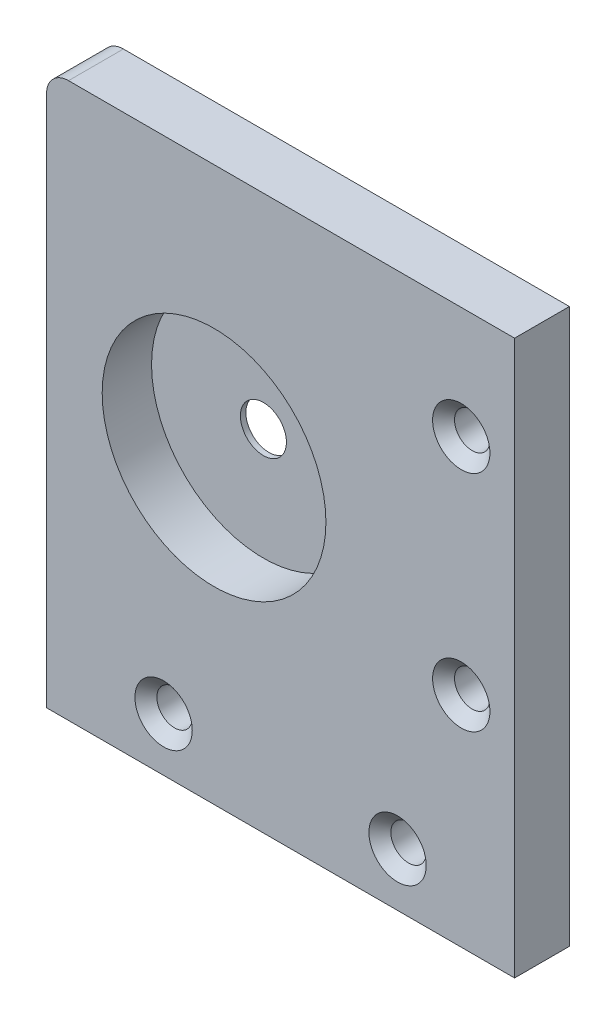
SolidWorks part; units mm, degrees
ref_plane "Front Plane" through (0, 0, 0) normal (0, 0, 1) x (1, 0, 0)
ref_plane "Top Plane" through (0, 0, 0) normal (0, 1, 0) x (1, 0, 0)
ref_plane "Right Plane" through (0, 0, 0) normal (1, 0, 0) x (0, 0, -1)
sketch "Sketch1" plane through (0, 0, 0) normal (0, 0, 1) x (1, 0, 0)
  line L6 (-810.8141, 612.9135) -> (-817.6657, 612.9135)
  line L7 (-810.8141, 612.9135) -> (-779.225, 612.9135)
  line L8 (-493.7649, 564.4955) -> (-493.7649, 1167.7963)
  line L9 (-493.7649, 1167.7963) -> (-817.6657, 1167.7963)
  line L10 (-817.6657, 1167.7963) -> (-817.6657, 564.4955)
  line L11 (-817.6657, 564.4955) -> (-493.7649, 564.4955)
  line L12 (-779.225, 612.9135) -> (-779.225, 571.3471)
  line L13 (-779.225, 571.3471) -> (-779.225, 564.4955)
  circle A2 centre (-798.6157, 583.5455) radius 2.667
extrude "Boss-Extrude1" add sketch "Sketch1" along normal blind 6.35 contours L13 L12 L7 L6 L10 L11 A2
sketch "Sketch2" plane through (0, 0, 6.35) normal (0, 0, 1) x (1, 0, 0)
  line L0 (-779.225, 564.4955) -> (-779.225, 555.0975)
  line L1 (-817.6657, 612.9135) -> (-827.0637, 612.9135)
  line L3 (-827.0637, 612.9135) -> (-779.225, 612.9135)
  line L4 (-779.225, 564.4955) -> (-779.225, 612.9135)
  line L5 (-779.225, 612.9135) -> (-817.6657, 612.9135)
  line L6 (-817.6657, 612.9135) -> (-817.6657, 564.4955)
  line L7 (-817.6657, 564.4955) -> (-779.225, 564.4955)
  line L8 (-779.225, 564.4955) -> (-779.225, 612.9135)
  line L9 (-779.225, 612.9135) -> (-817.6657, 612.9135)
  line L10 (-817.6657, 612.9135) -> (-817.6657, 564.4955)
  line L11 (-817.6657, 564.4955) -> (-779.225, 564.4955)
  line L12 (-827.0637, 612.9135) -> (-827.0637, 555.0975)
  line L13 (-827.0637, 555.0975) -> (-779.225, 555.0975)
  line L14 (-779.225, 612.9135) -> (-779.225, 555.0975)
  dimension "D2" = 9.398
  dimension "D1" = 0
extrude "Boss-Extrude2" add sketch "Sketch2" against normal up to vertex (996.0964 mm away) contours L12 L13 L0 L1 M15 M14
sketch "Sketch6" plane through (0, 0, 0) normal (0, 0, -1) x (-1, 0, 0)
  line L4 (779.225, 612.9135) -> (779.225, 555.0975)
  line L5 (779.225, 555.0975) -> (827.0637, 555.0975)
  line L6 (827.0637, 555.0975) -> (827.0637, 612.9135)
  line L7 (827.0637, 612.9135) -> (779.225, 612.9135)
  line L8 (779.225, 612.9135) -> (779.225, 555.0975)
  line L9 (779.225, 555.0975) -> (827.0637, 555.0975)
  line L10 (827.0637, 555.0975) -> (827.0637, 612.9135)
  line L11 (827.0637, 612.9135) -> (779.225, 612.9135)
  line L12 (804.9657, 562.1587) -> (817.4117, 562.1587)
  line L14 (819.1897, 562.1587) -> (820.0025, 562.1587)
  line L15 (820.0025, 562.1587) -> (820.0025, 612.9135)
  line L20 (817.4117, 562.1587) -> (819.1897, 562.1587)
  line L21 (804.9657, 562.1587) -> (779.225, 562.1587)
  dimension "D1" = 0
extrude "Boss-Extrude4" add sketch "Sketch6" along normal up to surface (78.0796 mm away) contours L12 L21 L8 L15 L14 L20 M11 M12 M13
sketch "Sketch7" plane through (0, 0, -78.0796) normal (0, 0, -1) x (-1, 0, 0)
  line L6 (805.2197, 576.9415) -> (805.2197, 612.9135)
  line L7 (779.225, 576.9415) -> (804.6609, 576.9415)
  line L8 (820.0025, 612.9135) -> (827.0637, 612.9135)
  line L9 (827.0637, 612.9135) -> (827.0637, 555.0975)
  line L10 (827.0637, 555.0975) -> (779.225, 555.0975)
  line L11 (779.225, 555.0975) -> (779.225, 562.1587)
  line L12 (779.225, 562.1587) -> (779.225, 576.9415)
  line L13 (820.0025, 612.9135) -> (805.2197, 612.9135)
  line L14 (804.6609, 576.9415) -> (805.2197, 576.9415)
  circle A2 centre (791.9609, 571.3471) radius 2.3812
  circle A3 centre (810.8141, 600.2587) radius 2.3812
sketch "Sketch8" plane through (0, 0, -78.0796) normal (0, 0, -1) x (-1, 0, 0)
  line L9 (805.2197, 612.9135) -> (805.2197, 576.9415)
  line L10 (820.0025, 612.9135) -> (805.2197, 612.9135)
  line L11 (827.0637, 612.9135) -> (820.0025, 612.9135)
  line L12 (827.0637, 555.0975) -> (827.0637, 612.9135)
  line L13 (779.225, 555.0975) -> (827.0637, 555.0975)
  line L14 (779.225, 562.1587) -> (779.225, 555.0975)
  line L15 (779.225, 576.9415) -> (779.225, 562.1587)
  line L16 (804.6609, 576.9415) -> (779.225, 576.9415)
  line L17 (805.2197, 576.9415) -> (804.6609, 576.9415)
  line L18 (805.2197, 612.9135) -> (805.2197, 576.9415)
  line L19 (820.0025, 612.9135) -> (805.2197, 612.9135)
  line L20 (827.0637, 612.9135) -> (820.0025, 612.9135)
  line L21 (827.0637, 555.0975) -> (827.0637, 612.9135)
  line L22 (779.225, 555.0975) -> (827.0637, 555.0975)
  line L23 (779.225, 562.1587) -> (779.225, 555.0975)
  line L24 (779.225, 576.9415) -> (779.225, 562.1587)
  line L25 (804.6609, 576.9415) -> (779.225, 576.9415)
  line L26 (805.2197, 576.9415) -> (804.6609, 576.9415)
  circle A1 centre (810.8141, 600.2587) radius 2.3813
  circle A2 centre (810.8141, 600.2587) radius 2.3812
  circle A3 centre (791.9609, 571.3471) radius 2.3813
  circle A4 centre (791.9609, 571.3471) radius 2.3812
  dimension "D1" = 0
  dimension "D2" = 0
  dimension "D3" = 0
extrude "Boss-Extrude6" add sketch "Sketch8" along normal blind 2.54
other "Cavity1"
other "5 SIDED ENCLOSURE 3 INCH.stp<1>@Assem11"
sketch "Sketch9" plane through (0, 612.9135, 0) normal (0, 1, 0) x (1, 0, 0)
  line L0 (-820.7645, 76.454) -> (-820.8153, 73.0504)
  line L1 (-820.8153, 3.1496) -> (-820.8153, 0)
  line L2 (-820.8153, 0) -> (-820.0025, 0)
  line L3 (-820.0025, 76.454) -> (-820.0025, 78.0796)
  line L4 (-820.0025, 78.0796) -> (-820.0025, 0)
  line L5 (-820.8153, 0) -> (-821.0693, 0)
  line L6 (-821.0693, 0) -> (-821.0693, 78.0796)
  line L7 (-821.0693, 78.0796) -> (-820.7645, 78.0796)
  line L12 (-820.7645, 76.454) -> (-820.7645, 78.0796)
  line L13 (-820.7645, 78.0796) -> (-805.2197, 78.0796)
  line L14 (-805.2197, 78.0796) -> (-805.2197, 80.6196)
  line L15 (-805.2197, 80.6196) -> (-827.0637, 80.6196)
  line L16 (-827.0637, 80.6196) -> (-827.0637, -6.35)
  line L17 (-827.0637, -6.35) -> (-779.225, -6.35)
  line L18 (-779.225, -6.35) -> (-779.225, 0)
  line L19 (-779.225, 0) -> (-820.0025, 0)
  line L20 (-820.0025, 0) -> (-820.0025, 1.0379)
  line L21 (-820.8153, 3.1496) -> (-820.8153, 73.0504)
  line L22 (-820.0025, 75.1621) -> (-820.0025, 76.454)
  line L23 (-820.0025, 76.454) -> (-820.7645, 76.454)
  line L24 (-820.7645, 76.454) -> (-820.7645, 78.0796)
  line L25 (-820.7645, 78.0796) -> (-805.2197, 78.0796)
  line L26 (-805.2197, 78.0796) -> (-805.2197, 80.6196)
  line L27 (-805.2197, 80.6196) -> (-827.0637, 80.6196)
  line L28 (-827.0637, 80.6196) -> (-827.0637, -6.35)
  line L29 (-827.0637, -6.35) -> (-779.225, -6.35)
  line L30 (-779.225, -6.35) -> (-779.225, 0)
  line L31 (-779.225, 0) -> (-820.0025, 0)
  line L32 (-820.0025, 0) -> (-820.0025, 1.0379)
  line L33 (-820.8153, 3.1496) -> (-820.8153, 73.0504)
  line L34 (-820.0025, 75.1621) -> (-820.0025, 76.454)
  line L35 (-820.0025, 76.454) -> (-820.7645, 76.454)
  arc A2 (-820.8153, 3.1496) -> (-820.0025, 1.0379) centre (-817.6657, 3.1496) ccw
  arc A3 (-820.0025, 75.1621) -> (-820.8153, 73.0504) centre (-817.6657, 73.0504) ccw
  arc A4 (-820.8153, 3.1496) -> (-820.0025, 1.0379) centre (-817.6657, 3.1496) ccw
  arc A5 (-820.0025, 75.1621) -> (-820.8153, 73.0504) centre (-817.6657, 73.0504) ccw
  dimension "D2" = 0.254
  dimension "D1" = 0
extrude "Cut-Extrude3" cut sketch "Sketch9" against normal up to surface (50.7548 mm away) contours L0 M28 M26 M27 | L7 L6 L5 L1 L0 M25 M26 M15 | L1 L2 M23 M24
sketch "Sketch10" plane through (-779.225, 0, 0) normal (1, 0, 0) x (0, 0, -1)
  line L0 (78.0796, 561.3459) -> (78.0796, 561.0919)
  line L1 (78.0796, 561.0919) -> (0, 561.0919)
  line L2 (0, 561.0919) -> (0, 562.1587)
  line L4 (24.4475, 562.1587) -> (24.4475, 561.3459) construction
  line L5 (24.4475, 562.1587) -> (24.4475, 561.3459)
  line L6 (0, 562.4127) -> (0, 562.1587)
  line L7 (0, 562.4127) -> (78.0796, 562.4127)
  line L8 (76.1963, 562.4127) -> (76.1963, 562.1587)
  line L9 (78.0796, 562.4127) -> (76.1963, 562.4127)
  line L10 (78.0796, 562.4127) -> (78.0796, 565.7277)
  line L11 (78.0796, 565.7277) -> (76.1963, 565.7277)
  line L12 (78.0796, 576.9415) -> (78.0796, 561.3459)
  line L13 (78.0796, 561.3459) -> (76.454, 561.3459)
  line L14 (76.454, 561.3459) -> (76.454, 562.1587)
  line L15 (76.454, 562.1587) -> (75.1621, 562.1587)
  line L16 (73.0504, 561.3459) -> (3.1496, 561.3459)
  line L17 (1.0379, 562.1587) -> (0, 562.1587)
  line L18 (0, 562.1587) -> (0, 612.9135)
  line L19 (0, 612.9135) -> (-6.35, 612.9135)
  line L20 (-6.35, 612.9135) -> (-6.35, 555.0975)
  line L21 (-6.35, 555.0975) -> (80.6196, 555.0975)
  line L22 (80.6196, 555.0975) -> (80.6196, 576.9415)
  line L23 (80.6196, 576.9415) -> (78.0796, 576.9415)
  line L24 (78.0796, 576.9415) -> (78.0796, 561.3459)
  line L25 (78.0796, 561.3459) -> (76.454, 561.3459)
  line L26 (76.454, 561.3459) -> (76.454, 562.1587)
  line L27 (76.454, 562.1587) -> (75.1621, 562.1587)
  line L28 (73.0504, 561.3459) -> (3.1496, 561.3459)
  line L29 (1.0379, 562.1587) -> (0, 562.1587)
  line L30 (0, 562.1587) -> (0, 612.9135)
  line L31 (0, 612.9135) -> (-6.35, 612.9135)
  line L32 (-6.35, 612.9135) -> (-6.35, 555.0975)
  line L33 (-6.35, 555.0975) -> (80.6196, 555.0975)
  line L34 (80.6196, 555.0975) -> (80.6196, 576.9415)
  line L35 (80.6196, 576.9415) -> (78.0796, 576.9415)
  line L36 (76.1963, 562.4127) -> (76.1963, 565.7277)
  line L37 (0, 561.0919) -> (3.4229, 561.0919)
  line L38 (0, 561.0919) -> (0, 564.0863)
  line L39 (0, 564.0863) -> (3.4229, 564.0863)
  line L40 (3.4229, 561.0919) -> (3.4229, 564.0863)
  arc A2 (73.0504, 561.3459) -> (75.1621, 562.1587) centre (73.0504, 564.4955) ccw
  arc A3 (1.0379, 562.1587) -> (3.1496, 561.3459) centre (3.1496, 564.4955) ccw
  arc A4 (73.0504, 561.3459) -> (75.1621, 562.1587) centre (73.0504, 564.4955) ccw
  arc A5 (1.0379, 562.1587) -> (3.1496, 561.3459) centre (3.1496, 564.4955) ccw
  dimension "D2" = 0.254
  dimension "D3" = 0.254
  dimension "D1" = 0
extrude "Cut-Extrude5" cut sketch "Sketch10" against normal up to surface (41.8444 mm away)
sketch "Sketch12" plane through (0, 0, -80.6196) normal (0, 0, -1) x (-1, 0, 0)
  line L6 (827.0637, 612.9135) -> (805.2197, 612.9135)
  line L7 (805.2197, 612.9135) -> (805.2197, 576.9415)
  line L8 (805.2197, 576.9415) -> (779.225, 576.9415)
  line L9 (779.225, 576.9415) -> (779.225, 555.0975)
  line L10 (779.225, 555.0975) -> (827.0637, 555.0975)
  line L11 (827.0637, 555.0975) -> (827.0637, 612.9135)
  line L12 (827.0637, 612.9135) -> (805.2197, 612.9135)
  line L13 (805.2197, 612.9135) -> (805.2197, 576.9415)
  line L14 (805.2197, 576.9415) -> (779.225, 576.9415)
  line L15 (779.225, 576.9415) -> (779.225, 555.0975)
  line L16 (779.225, 555.0975) -> (827.0637, 555.0975)
  line L17 (827.0637, 555.0975) -> (827.0637, 612.9135)
  circle A1 centre (791.9609, 571.3471) radius 2.3813
  circle A2 centre (791.9609, 571.3471) radius 2.3812
  circle A3 centre (810.8141, 600.2587) radius 2.3813
  circle A4 centre (810.8141, 600.2587) radius 2.3812
  dimension "D1" = 0
  dimension "D2" = 0
  dimension "D3" = 0
extrude "Boss-Extrude7" add sketch "Sketch12" along normal blind 3.81
sketch "Sketch13" plane through (0, 0, -84.4296) normal (0, 0, -1) x (-1, 0, 0)
  line L0 (797.5235, 571.3471) -> (797.5235, 576.9415)
  line L1 (805.2197, 576.9415) -> (779.225, 576.9415) construction
  line L2 (786.3983, 571.3471) -> (786.3983, 576.9415)
  line L3 (810.8141, 594.6961) -> (805.2197, 594.6961)
  line L4 (805.2197, 612.9135) -> (805.2197, 576.9415) construction
  line L5 (810.8141, 605.8213) -> (805.2197, 605.8213)
  line L12 (827.0637, 612.9135) -> (805.2197, 612.9135)
  line L13 (805.2197, 612.9135) -> (805.2197, 576.9415)
  line L14 (805.2197, 576.9415) -> (779.225, 576.9415)
  line L15 (779.225, 576.9415) -> (779.225, 555.0975)
  line L16 (779.225, 555.0975) -> (827.0637, 555.0975)
  line L17 (827.0637, 555.0975) -> (827.0637, 612.9135)
  line L18 (827.0637, 612.9135) -> (805.2197, 612.9135)
  line L19 (805.2197, 612.9135) -> (805.2197, 576.9415)
  line L20 (805.2197, 576.9415) -> (779.225, 576.9415)
  line L21 (779.225, 576.9415) -> (779.225, 555.0975)
  line L22 (779.225, 555.0975) -> (827.0637, 555.0975)
  line L23 (827.0637, 555.0975) -> (827.0637, 612.9135)
  circle A2 centre (810.8141, 600.2587) radius 3.0226
  circle A3 centre (791.9609, 571.3471) radius 3.0226
  circle A4 centre (791.9609, 571.3471) radius 5.5626
  circle A5 centre (810.8141, 600.2587) radius 5.5626
  dimension "D1" = 2.54
  dimension "D2" = 0
extrude "Cut-Extrude7" cut sketch "Sketch13" against normal blind 5.715 contours M16 | A5 A2 | A5 L5 L3 M7 | M3 | A3 M3 | A4 A3 | A4 L0 L2 M9
fillet "Fillet3" radius 1.27 4 edges at (-805.2197, 605.8213, -81.5721) (-805.2197, 594.6961, -81.5721) (-797.5235, 576.9415, -81.5721) (-786.3983, 576.9415, -81.5721)
sketch "Sketch14" plane through (0, 0, 6.35) normal (0, 0, 1) x (1, 0, 0)
  line L4 (-779.225, 612.9135) -> (-827.0637, 612.9135)
  line L5 (-827.0637, 612.9135) -> (-827.0637, 555.0975)
  line L6 (-827.0637, 555.0975) -> (-779.225, 555.0975)
  line L7 (-779.225, 555.0975) -> (-779.225, 612.9135)
  line L8 (-779.225, 612.9135) -> (-827.0637, 612.9135)
  line L9 (-827.0637, 612.9135) -> (-827.0637, 555.0975)
  line L10 (-827.0637, 555.0975) -> (-779.225, 555.0975)
  line L11 (-779.225, 555.0975) -> (-779.225, 612.9135)
  circle A1 centre (-798.6157, 583.5455) radius 12.7
  circle A2 centre (-798.6157, 583.5455) radius 12.954
  dimension "D1" = 0
  dimension "D2" = 0.254
extrude "Cut-Extrude8" cut sketch "Sketch14" against normal blind 5.715 contours A2 A1 | A1 M9 | M9
fillet "Fillet4" radius 2.54 3 edges at (-779.225, 576.9415, -81.2546) (-805.2197, 612.9135, -81.2546) (-779.225, 612.9135, 3.175)
sketch "Sketch15" plane through (0, 0, -84.4296) normal (0, 0, -1) x (-1, 0, 0)
  line L4 (821.0693, 612.9135) -> (781.765, 612.9135)
  line L5 (779.225, 610.3735) -> (779.225, 561.0919)
  line L6 (779.225, 561.0919) -> (821.0693, 561.0919)
  line L7 (821.0693, 561.0919) -> (821.0693, 612.9135)
  line L8 (821.0693, 612.9135) -> (781.765, 612.9135)
  line L9 (779.225, 610.3735) -> (779.225, 561.0919)
  line L10 (779.225, 561.0919) -> (821.0693, 561.0919)
  line L11 (821.0693, 561.0919) -> (821.0693, 612.9135)
  line L20 (785.1283, 576.9415) -> (781.765, 576.9415)
  line L21 (779.225, 574.4015) -> (779.225, 555.0975)
  line L22 (779.225, 555.0975) -> (827.0637, 555.0975)
  line L23 (827.0637, 555.0975) -> (827.0637, 612.9135)
  line L24 (827.0637, 612.9135) -> (807.7597, 612.9135)
  line L25 (805.2197, 610.3735) -> (805.2197, 607.0913)
  line L26 (806.4897, 605.8213) -> (810.8141, 605.8213)
  line L27 (810.8141, 594.6961) -> (806.4897, 594.6961)
  line L28 (805.2197, 593.4261) -> (805.2197, 576.9415)
  line L29 (805.2197, 576.9415) -> (798.7935, 576.9415)
  line L30 (797.5235, 575.6715) -> (797.5235, 571.3471)
  line L31 (786.3983, 571.3471) -> (786.3983, 575.6715)
  line L32 (785.1283, 576.9415) -> (781.765, 576.9415)
  line L33 (779.225, 574.4015) -> (779.225, 555.0975)
  line L34 (779.225, 555.0975) -> (827.0637, 555.0975)
  line L35 (827.0637, 555.0975) -> (827.0637, 612.9135)
  line L36 (827.0637, 612.9135) -> (807.7597, 612.9135)
  line L37 (805.2197, 610.3735) -> (805.2197, 607.0913)
  line L38 (806.4897, 605.8213) -> (810.8141, 605.8213)
  line L39 (810.8141, 594.6961) -> (806.4897, 594.6961)
  line L40 (805.2197, 593.4261) -> (805.2197, 576.9415)
  line L41 (805.2197, 576.9415) -> (798.7935, 576.9415)
  line L42 (797.5235, 575.6715) -> (797.5235, 571.3471)
  line L43 (786.3983, 571.3471) -> (786.3983, 575.6715)
  arc A1 (781.765, 612.9135) -> (779.225, 610.3735) centre (781.765, 610.3735) ccw
  arc A2 (781.765, 612.9135) -> (779.225, 610.3735) centre (781.765, 610.3735) ccw
  arc A10 (781.765, 576.9415) -> (779.225, 574.4015) centre (781.765, 574.4015) ccw
  arc A11 (807.7597, 612.9135) -> (805.2197, 610.3735) centre (807.7597, 610.3735) ccw
  arc A12 (805.2197, 607.0913) -> (806.4897, 605.8213) centre (806.4897, 607.0913) ccw
  arc A13 (810.8141, 594.6961) -> (810.8141, 605.8213) centre (810.8141, 600.2587) ccw
  arc A14 (806.4897, 594.6961) -> (805.2197, 593.4261) centre (806.4897, 593.4261) ccw
  arc A15 (798.7935, 576.9415) -> (797.5235, 575.6715) centre (798.7935, 575.6715) ccw
  arc A16 (786.3983, 571.3471) -> (797.5235, 571.3471) centre (791.9609, 571.3471) ccw
  arc A17 (786.3983, 575.6715) -> (785.1283, 576.9415) centre (785.1283, 575.6715) ccw
  arc A18 (781.765, 576.9415) -> (779.225, 574.4015) centre (781.765, 574.4015) ccw
  arc A19 (807.7597, 612.9135) -> (805.2197, 610.3735) centre (807.7597, 610.3735) ccw
  arc A20 (805.2197, 607.0913) -> (806.4897, 605.8213) centre (806.4897, 607.0913) ccw
  arc A21 (810.8141, 594.6961) -> (810.8141, 605.8213) centre (810.8141, 600.2587) ccw
  arc A22 (806.4897, 594.6961) -> (805.2197, 593.4261) centre (806.4897, 593.4261) ccw
  arc A23 (798.7935, 576.9415) -> (797.5235, 575.6715) centre (798.7935, 575.6715) ccw
  arc A24 (786.3983, 571.3471) -> (797.5235, 571.3471) centre (791.9609, 571.3471) ccw
  arc A25 (786.3983, 575.6715) -> (785.1283, 576.9415) centre (785.1283, 575.6715) ccw
  dimension "D1" = 0
  dimension "D2" = 0
extrude "Cut-Extrude9" cut sketch "Sketch15" against normal up to surface (84.4296 mm away) contours L11 L10 M28 M29 M30 M31 | L10 L11 M31 M32 M33 M34 M35 M36 M37 M38 M39 M40 M41 M42 M43 M44 M45 M26 M27 M28 | L8 A2 L9 M27 M26 M45 M44 M43 M42 M41 M40 M39 M38 M37 M36 M35 M34 M33 M32
ref_plane "Plane1" through (-829.6037, 0, 0) normal (-1, 0, 0) x (0, 0, 1)
mirror "Mirror6" about plane through (-829.6037, 0, 0) normal (-1, 0, 0)
sketch "Sketch17" plane through (0, 0, 0) normal (0, 0, -1) x (-1, 0, 0)
  line L4 (827.0637, 555.0975) -> (827.0637, 612.9135)
  line L5 (827.0637, 612.9135) -> (781.765, 612.9135)
  line L6 (779.225, 610.3735) -> (779.225, 555.0975)
  line L7 (779.225, 555.0975) -> (827.0637, 555.0975)
  line L8 (827.0637, 555.0975) -> (827.0637, 612.9135)
  line L9 (827.0637, 612.9135) -> (781.765, 612.9135)
  line L10 (779.225, 610.3735) -> (779.225, 555.0975)
  line L11 (779.225, 555.0975) -> (827.0637, 555.0975)
  arc A1 (781.765, 612.9135) -> (779.225, 610.3735) centre (781.765, 610.3735) ccw
  arc A2 (781.765, 612.9135) -> (779.225, 610.3735) centre (781.765, 610.3735) ccw
  dimension "D1" = 0
extrude "Cut-Extrude10" cut sketch "Sketch17" against normal through all
sketch "Sketch18" plane through (0, 0, 6.35) normal (0, 0, 1) x (1, 0, 0)
  line L4 (-879.9825, 610.3735) -> (-879.9825, 555.0975)
  line L5 (-879.9825, 555.0975) -> (-832.1437, 555.0975)
  line L6 (-832.1437, 555.0975) -> (-832.1437, 612.9135)
  line L7 (-832.1437, 612.9135) -> (-877.4425, 612.9135)
  line L8 (-879.9825, 610.3735) -> (-879.9825, 555.0975)
  line L9 (-879.9825, 555.0975) -> (-832.1437, 555.0975)
  line L10 (-832.1437, 555.0975) -> (-832.1437, 612.9135)
  line L11 (-832.1437, 612.9135) -> (-877.4425, 612.9135)
  line L16 (-832.1437, 555.0975) -> (-825.7937, 555.0975)
  line L17 (-825.7937, 555.0975) -> (-825.7937, 612.9135)
  line L18 (-825.7937, 612.9135) -> (-832.1437, 612.9135)
  line L19 (-832.1437, 612.9135) -> (-832.1437, 555.0975)
  line L20 (-825.7937, 548.7475) -> (-825.7937, 555.0975)
  line L21 (-825.7937, 555.0975) -> (-879.9825, 555.0975)
  line L22 (-879.9825, 555.0975) -> (-879.9825, 548.7475)
  line L23 (-879.9825, 548.7475) -> (-825.7937, 548.7475)
  arc A1 (-877.4425, 612.9135) -> (-879.9825, 610.3735) centre (-877.4425, 610.3735) ccw
  arc A2 (-877.4425, 612.9135) -> (-879.9825, 610.3735) centre (-877.4425, 610.3735) ccw
  dimension "D1" = 0
extrude "Boss-Extrude8" add sketch "Sketch18" against normal up to surface (6.35 mm away) contours L22 L23 L20 L16 M8 | L17 L18 L16 M9
sketch "Sketch19" plane through (0, 0, 6.35) normal (0, 0, 1) x (1, 0, 0)
  line L1 (-841.5417, 564.4955) -> (-1165.4425, 564.4955)
  line L2 (-1003.4921, 564.4955) -> (-1003.4921, 530.1559)
  circle A4 centre (-1140.549, 554.9197) radius 2.05
  circle A5 centre (-1167.6434, 554.9197) radius 2.05
  circle A6 centre (-1175.0183, 574.0473) radius 2.05
  circle A7 centre (-1175.0183, 599.9581) radius 2.05
  circle A8 centre (-831.9659, 599.9581) radius 2.05
  circle A9 centre (-831.9659, 574.0473) radius 2.05
  circle A10 centre (-839.3409, 554.9197) radius 2.05
  circle A11 centre (-866.4353, 554.9197) radius 2.05
extrude "Cut-Extrude11" cut sketch "Sketch19" against normal through all contours A8 | A10 | A11 | A9
chamfer "Chamfer1" distance 1.27 angle 45 4 edges at (-864.3853, 554.9197, 6.35) (-837.2909, 554.9197, 6.35) (-834.0159, 574.0473, 6.35) (-829.9159, 599.9581, 6.35)
